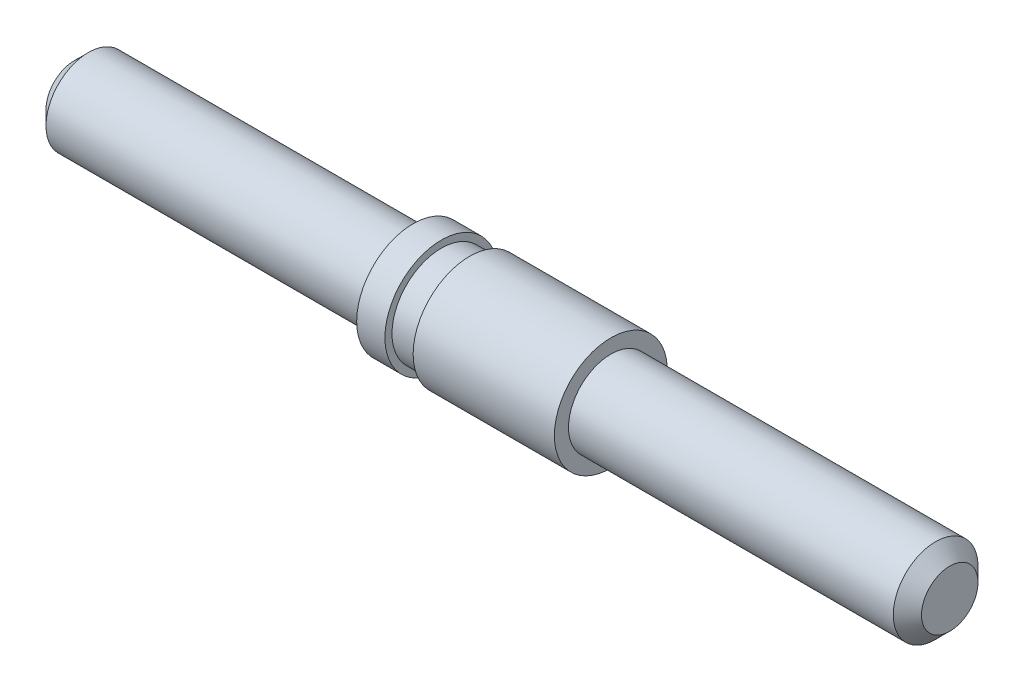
SolidWorks part; units mm, degrees
ref_plane "Plan1" through (0, 0, 0) normal (0, 0, 1) x (1, 0, 0)
ref_plane "Plan2" through (0, 0, 0) normal (0, 1, 0) x (1, 0, 0)
ref_plane "Plan3" through (0, 0, 0) normal (1, 0, 0) x (0, 0, -1)
ref_plane "Plan4" through (0, 0, 0) normal (0, 0, -1) x (-1, 0, 0)
sketch "Esquisse1" plane through (0, 0, 0) normal (0, 0, -1) x (-1, 0, 0)
  line L0 (-26, 21) -> (-26, 20)
  line L1 (-26, 20) -> (5, 20)
  line L2 (5, 20) -> (5, 21)
  line L3 (5, 21) -> (4.5, 21.5)
  line L4 (4.5, 21.5) -> (-7, 21.5)
  line L5 (-7, 21.5) -> (-7, 22)
  line L6 (-7, 22) -> (-8, 22)
  line L7 (-8, 22) -> (-8, 21.75)
  line L8 (-8, 21.75) -> (-9, 21.75)
  line L9 (-9, 21.75) -> (-9, 22)
  line L10 (-9, 22) -> (-14, 22)
  line L11 (-14, 22) -> (-14, 21.5)
  line L12 (-14, 21.5) -> (-25.5, 21.5)
  line L13 (-25.5, 21.5) -> (-26, 21)
  line L14 (-26, 20) -> (5, 20) construction
revolve "Base-Révolution" add sketch "Esquisse1" angle 360 about L14
